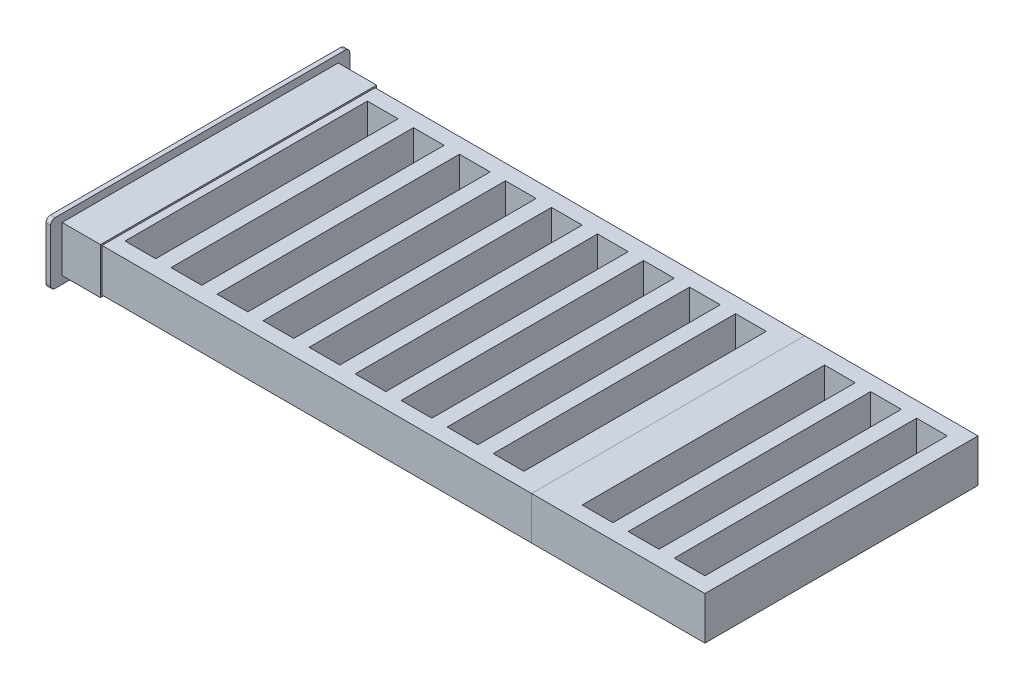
SolidWorks part; units mm, degrees
ref_plane "Plan de face" through (0, 0, 0) normal (0, 0, 1) x (1, 0, 0)
ref_plane "Plan de dessus" through (0, 0, 0) normal (0, 1, 0) x (1, 0, 0)
ref_plane "Plan de droite" through (0, 0, 0) normal (1, 0, 0) x (0, 0, -1)
sketch "Esquisse1" plane through (0, 0, 0) normal (0, 1, 0) x (1, 0, 0)
  line L0 (-152.5, -89) -> (152.5, 89) construction
  line L1 (-152.5, 89) -> (152.5, 89)
  line L2 (-152.5, 89) -> (-152.5, -89)
  line L3 (-152.5, -89) -> (152.5, -89)
  line L4 (152.5, 89) -> (152.5, -89)
  dimension "D1" = 305
  dimension "D2" = 178
extrude "Extrusion1" add sketch "Esquisse1" along normal mid plane 28
sketch "Esquisse2" plane through (-152.5, 0, 0) normal (-1, 0, 0) x (0, 0, 1)
  line L0 (-97.5, -20) -> (97.5, 20) construction
  line L1 (-97.5, 20) -> (97.5, 20)
  line L2 (-97.5, 20) -> (-97.5, -20)
  line L3 (-97.5, -20) -> (97.5, -20)
  line L4 (97.5, 20) -> (97.5, -20)
  dimension "D1" = 195
  dimension "D2" = 40
extrude "Extrusion2" add sketch "Esquisse2" along normal blind 3
fillet "Congé1" radius 3 4 edges at (-154, -20, 97.5) (-154, -20, -97.5) (-154, 20, -97.5) (-154, 20, 97.5)
sketch "Esquisse3" plane through (0, 14, 0) normal (0, 1, 0) x (-1, 0, 0)
  line L0 (152.5, -89) -> (152.5, 89) construction
  line L1 (152.5, 90) -> (127.5, 90)
  line L2 (152.5, 90) -> (152.5, -90)
  line L3 (152.5, -90) -> (127.5, -90)
  line L4 (127.5, 90) -> (127.5, -90)
  line L5 (152.5, 89) -> (-152.5, 89) construction
  line L6 (-152.5, -89) -> (152.5, -89) construction
  dimension "D1" = 25
  dimension "D2" = 1
  dimension "D3" = 1
extrude "Extrusion3" add sketch "Esquisse3" along normal blind 1 and the other way blind 29
sketch "Esquisse4" plane through (0, 14, 0) normal (0, 1, 0) x (-1, 0, 0)
  line L0 (-152.5, -89) -> (127.5, -89) construction
  line L1 (102.5, -79) -> (122.5, -79)
  line L2 (102.5, -79) -> (102.5, 79)
  line L3 (102.5, 79) -> (122.5, 79)
  line L4 (122.5, -79) -> (122.5, 79)
  line L5 (127.5, 89) -> (-152.5, 89) construction
  line L6 (127.5, 90) -> (127.5, -90) construction
  dimension "D1" = 10
  dimension "D2" = 10
  dimension "D3" = 5
  dimension "D4" = 20
extrude "Enlèv. mat.-Extru.1" cut sketch "Esquisse4" against normal up to next
pattern_linear "Répétition linéaire1" count 9 spacing 30 along (1, 0, 0) of "Enlèv. mat.-Extru.1"
sketch "Esquisse5" plane through (0, 14, 0) normal (0, 1, 0) x (-1, 0, 0)
  line L0 (-137.5, -79) -> (-117.5, -79) construction
  line L1 (-152.5, -89) -> (-265.5, -89)
  line L2 (-152.5, -89) -> (-152.5, 89)
  line L3 (-152.5, 89) -> (-265.5, 89)
  line L4 (-265.5, -89) -> (-265.5, 89)
  line L5 (-255.5, -79) -> (-235.5, -79)
  line L6 (-255.5, -79) -> (-255.5, 79)
  line L7 (-255.5, 79) -> (-235.5, 79)
  line L8 (-235.5, -79) -> (-235.5, 79)
  line L9 (-225.5, -79) -> (-205.5, -79)
  line L10 (-225.5, -79) -> (-225.5, 79)
  line L11 (-225.5, 79) -> (-205.5, 79)
  line L12 (-205.5, -79) -> (-205.5, 79)
  line L13 (-195.5, -79) -> (-175.5, -79)
  line L14 (-195.5, -79) -> (-195.5, 79)
  line L15 (-195.5, 79) -> (-175.5, 79)
  line L16 (-175.5, -79) -> (-175.5, 79)
  line L17 (-117.5, 79) -> (-137.5, 79) construction
  dimension "D1" = 113
  dimension "D2" = 10
  dimension "D3" = 10
  dimension "D4" = 10
extrude "Extrusion4" add sketch "Esquisse5" against normal up to surface (28 mm away) separate body
